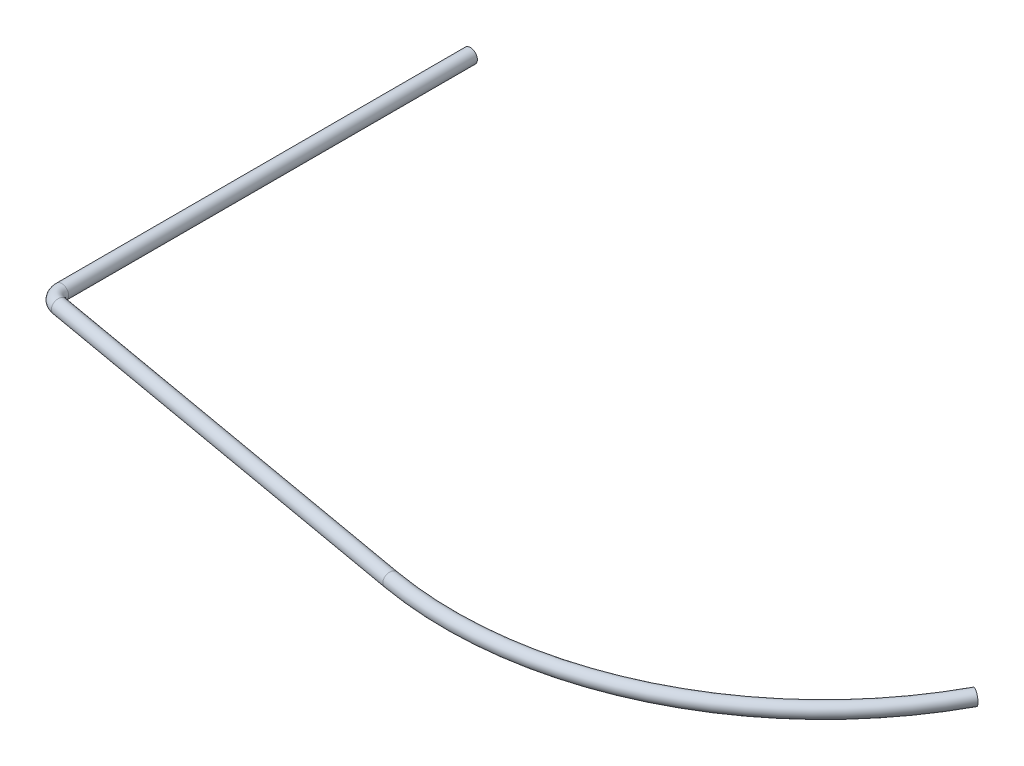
SolidWorks part; units mm, degrees
ref_plane "Front Plane" through (0, 0, 0) normal (0, 0, 1) x (1, 0, 0)
ref_plane "Top Plane" through (0, 0, 0) normal (0, 1, 0) x (1, 0, 0)
ref_plane "Right Plane" through (0, 0, 0) normal (1, 0, 0) x (0, 0, -1)
sketch "Sketch1" plane through (0, 0, 0) normal (0, 1, 0) x (1, 0, 0)
  line L0 (0, 0) -> (0, -87.4827)
  line L1 (2.4791, -90.4371) -> (88.6327, -105.6283)
  line L2 (102.5246, -26.8437) -> (88.6327, -105.6283) construction
  line L3 (102.5246, -26.8437) -> (172.9164, -64.8568) construction
  arc A0 (88.6327, -105.6283) -> (172.9164, -64.8568) centre (102.5246, -26.8437) ccw
  arc A1 (2.4791, -90.4371) -> (0, -87.4827) centre (3, -87.4827) cw
  point P8 (0, -90)
  dimension "D4" = 80
  dimension "D5" = 71.63
  dimension "D6" = 3
  dimension "D1" = 100
  dimension "D2" = 90
  dimension "D3" = 90
sketch "Sketch2" plane through (0, 0, 0) normal (0, 0, 1) x (1, 0, 0)
  circle A0 centre (0, 0) radius 1.5
  dimension "D1" = 3
sweep "Sweep1" add profiles "Sketch2" path "Sketch1"
